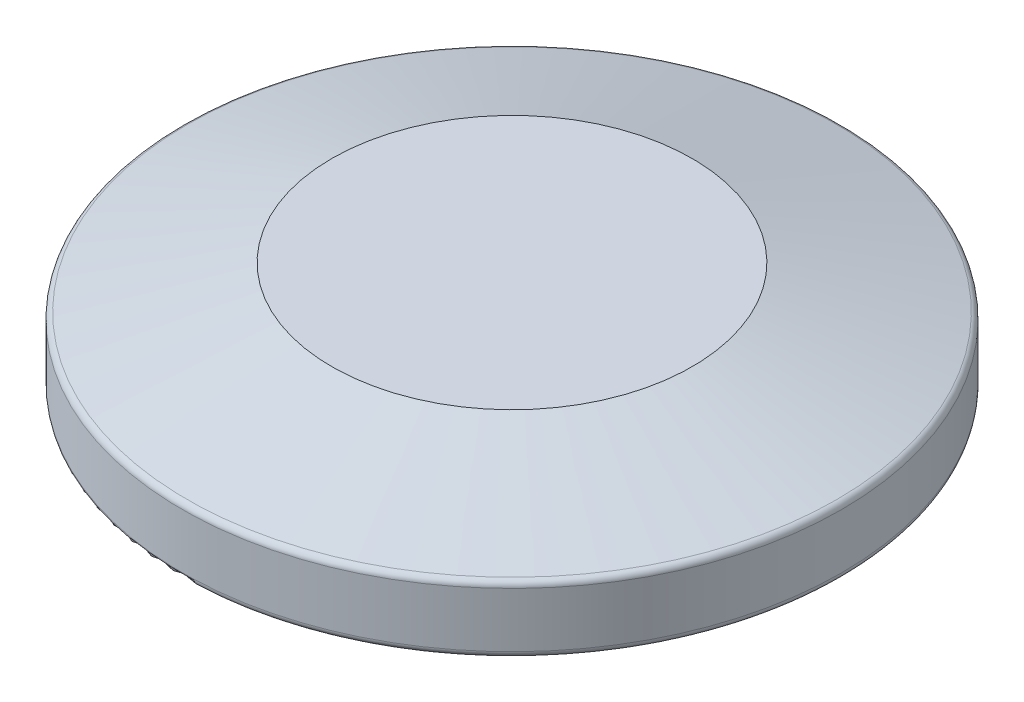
SolidWorks part; units mm, degrees
ref_plane "前视基准面" through (0, 0, 0) normal (0, 0, 1) x (1, 0, 0)
ref_plane "上视基准面" through (0, 0, 0) normal (0, 1, 0) x (1, 0, 0)
ref_plane "右视基准面" through (0, 0, 0) normal (1, 0, 0) x (0, 0, -1)
other "Configuration Table"
sketch "草图1" plane through (0, 0, 0) normal (0, 0, 1) x (1, 0, 0)
  line L0 (0, 0) -> (-5.35, 0)
  line L1 (-5.35, 0) -> (-8.65, 0)
  line L2 (-8.65, 0) -> (-14.9, 0)
  line L3 (-14.9, 0) -> (-14.9, 3)
  line L4 (-14.9, 3) -> (-8.15, 5)
  line L5 (-8.15, 5) -> (0, 5)
  line L6 (0, 5) -> (0, 0)
  line L7 (-8.65, 0) -> (-8.65, 2.5)
  line L8 (-8.65, 2.5) -> (-5.35, 2.5)
  line L9 (-5.35, 2.5) -> (-5.35, 0)
  dimension "D1" = 5.35
  dimension "D2" = 3.3
  dimension "D3" = 6.25
  dimension "D4" = 3
  dimension "D5" = 5
  dimension "D6" = 8.15
  dimension "D7" = 2.5
revolve "旋转1" add sketch "草图1" angle 360 about L6
fillet "圆角1" radius 0.3 1 edges at (-14.9, 3, 0)
fillet "圆角2" radius 0.3 1 edges at (-14.9, 0, 0)
fillet "圆角3" radius 0.3 1 edges at (-8.65, 0, 0)
